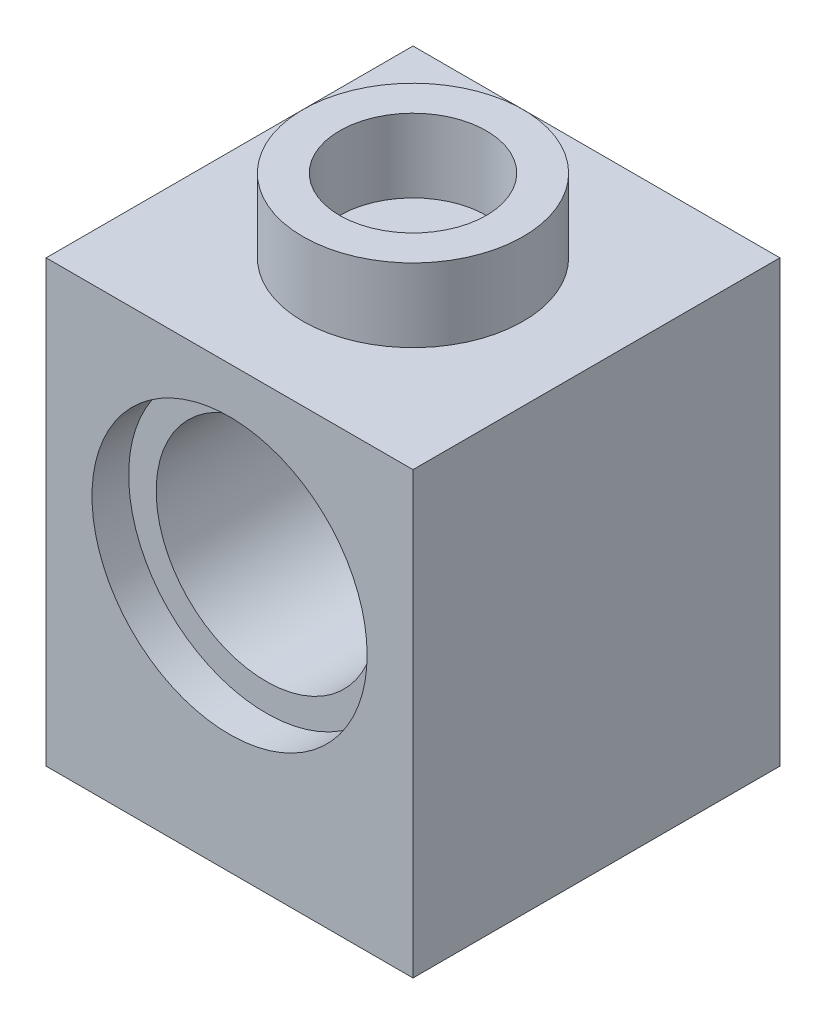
SolidWorks part; units mm, degrees
ref_plane "Front Plane" through (0, 0, 0) normal (0, 0, 1) x (1, 0, 0)
ref_plane "Top Plane" through (0, 0, 0) normal (0, 1, 0) x (1, 0, 0)
ref_plane "Right Plane" through (0, 0, 0) normal (1, 0, 0) x (0, 0, -1)
sketch "Sketch1" plane through (0, 0, 0) normal (0, 1, 0) x (1, 0, 0)
  line L0 (0, 0) -> (8, 0)
  line L1 (0, 0) -> (0, 8)
  line L2 (8, 0) -> (8, 8)
  line L3 (8, 8) -> (0, 8)
  dimension "D1" = 8
  dimension "D2" = 8
extrude "Boss-Extrude1" add sketch "Sketch1" along normal blind 9.6
sketch "Sketch2" plane through (0, 0, 0) normal (0, 0, 1) x (1, 0, 0)
  line L0 (0, 0) -> (8, 0) construction
  circle A0 centre (4, 5.6) radius 3
  dimension "D1" = 6
  dimension "D2" = 5.6
extrude "Cut-Extrude1" cut sketch "Sketch2" against normal blind 0.8
sketch "Sketch3" plane through (0, 0, 0) normal (0, 0, 1) x (1, 0, 0)
  line L0 (0, 0) -> (8, 0) construction
  circle A0 centre (4, 5.6) radius 2.4
  dimension "D1" = 4.8
  dimension "D2" = 5.6
extrude "Cut-Extrude2" cut sketch "Sketch3" against normal blind 11.8
sketch "Sketch4" plane through (0, 9.6, 0) normal (0, 1, 0) x (1, 0, 0)
  line L0 (0, 4) -> (8, 4) construction
  line L1 (0, 8) -> (0, 0) construction
  line L2 (8, 0) -> (8, 8) construction
ref_plane "Plane1" through (0, 0, -4) normal (0, 0, 1) x (1, 0, 0)
mirror "Mirror1" about plane through (0, 0, -4) normal (0, 0, 1) of "Cut-Extrude1"
sketch "Sketch5" plane through (0, 9.6, 0) normal (0, 1, 0) x (1, 0, 0)
  line L0 (4, 8) -> (4, 0) construction
  line L1 (8, 8) -> (0, 8) construction
  line L2 (0, 0) -> (8, 0) construction
  circle A0 centre (4, 4) radius 2.4
  circle A1 centre (4, 4) radius 1.6
  dimension "D1" = 4.8
  dimension "D2" = 3.2
extrude "Boss-Extrude2" add sketch "Sketch5" along normal blind 1.6
sketch "Sketch6" plane through (0, 0, 0) normal (0, -1, 0) x (1, 0, 0)
  line L0 (0, -8) -> (0, 0) construction
  line L1 (1.6, -6.4) -> (6.4, -6.4)
  line L2 (1.6, -6.4) -> (1.6, -1.6)
  line L3 (1.6, -1.6) -> (6.4, -1.6)
  line L4 (6.4, -6.4) -> (6.4, -1.6)
  line L5 (0, 0) -> (8, 0) construction
  line L6 (8, -8) -> (0, -8) construction
  line L7 (8, 0) -> (8, -8) construction
  dimension "D1" = 1.6
  dimension "D2" = 1.6
  dimension "D3" = 1.6
  dimension "D4" = 1.6
extrude "Cut-Extrude3" cut sketch "Sketch6" against normal blind 1.6
